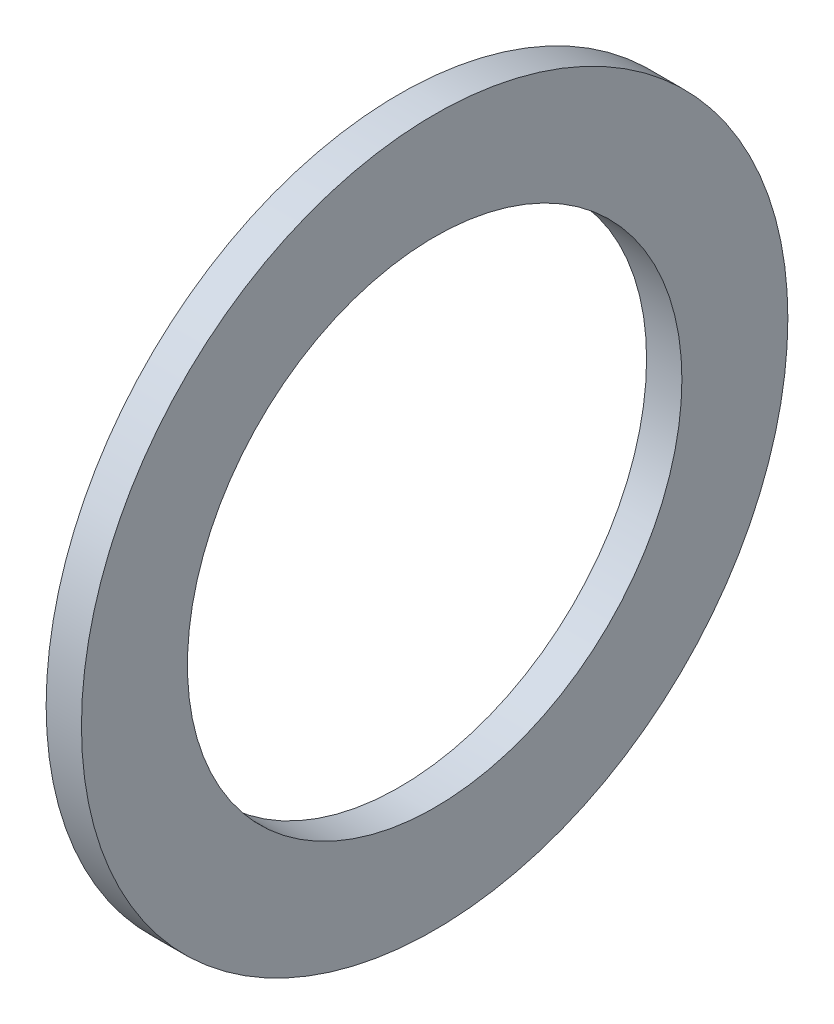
SolidWorks part; units mm, degrees
ref_plane "face" through (0, 0, 0) normal (0, 0, 1) x (1, 0, 0)
ref_plane "dessus" through (0, 0, 0) normal (0, 1, 0) x (1, 0, 0)
ref_plane "droite" through (0, 0, 0) normal (1, 0, 0) x (0, 0, -1)
sketch "Esquisse1" plane through (0, 0, 0) normal (0, 0, 1) x (1, 0, 0)
  line L0 (0, 0) -> (0, -5)
  line L1 (0, -5) -> (-0.5, -5)
  line L2 (-0.5, -5) -> (-0.5, 0)
  line L3 (-0.5, 0) -> (0, 0)
  line L4 (0, 0) -> (-10, 0) construction
  dimension "D1" = 5
  dimension "D2" = 0.5
revolve "Base-Révolution" add sketch "Esquisse1" angle 360 about L4
sketch "Esquisse2" plane through (0, 0, 0) normal (1, 0, 0) x (0, 0, -1)
  circle A0 centre (0, 0) radius 3.5
  dimension "D1" = 7
extrude "Enlèv. mat.-Extru.2" cut sketch "Esquisse2" against normal blind 10
